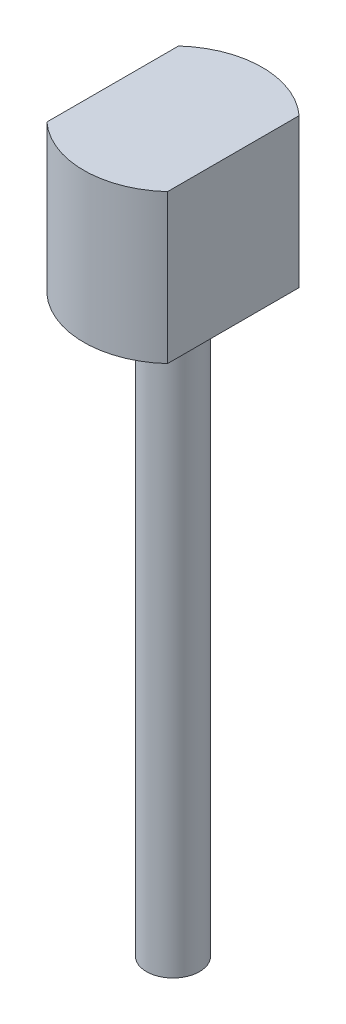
SolidWorks part; units mm, degrees
ref_plane "Front Plane" through (0, 0, 0) normal (0, 0, 1) x (1, 0, 0)
ref_plane "Top Plane" through (0, 0, 0) normal (0, 1, 0) x (1, 0, 0)
ref_plane "Right Plane" through (0, 0, 0) normal (1, 0, 0) x (0, 0, -1)
sketch "Sketch1" plane through (0, 0, 0) normal (0, 1, 0) x (1, 0, 0)
  line L0 (0, -3.5) -> (0, 3.5) construction
  line L1 (-2.365, -2.5801) -> (-2.365, 2.5801)
  line L2 (2.365, -2.5801) -> (2.365, 2.5801)
  arc A0 (-2.365, -2.5801) -> (2.365, -2.5801) centre (0, 0) ccw
  arc A1 (2.365, 2.5801) -> (-2.365, 2.5801) centre (0, 0) ccw
  dimension "D1" = 7
  dimension "D2" = 4.73
extrude "Boss-Extrude1" add sketch "Sketch1" along normal blind 5.84
sketch "Sketch2" plane through (0, 0, 0) normal (0, -1, 0) x (1, 0, 0)
  circle A0 centre (0, 0) radius 1.0414
  dimension "D1" = 2.0828
extrude "Boss-Extrude2" add sketch "Sketch2" along normal blind 22.6
